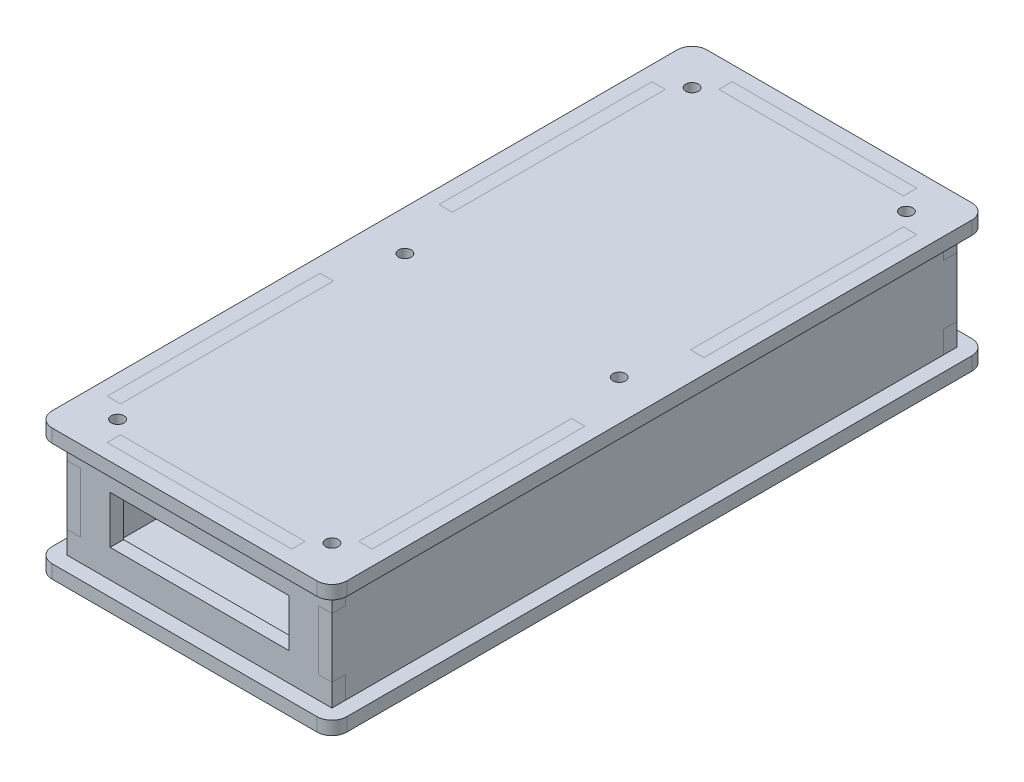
SolidWorks part; units mm, degrees
ref_plane "Front Plane" through (0, 0, 0) normal (0, 0, 1) x (1, 0, 0)
ref_plane "Top Plane" through (0, 0, 0) normal (0, 1, 0) x (1, 0, 0)
ref_plane "Right Plane" through (0, 0, 0) normal (1, 0, 0) x (0, 0, -1)
sketch "BasicDimensioning" plane through (0, 0, 0) normal (0, 1, 0) x (1, 0, 0)
  line L0 (-40, -986.8757) -> (-40, 49013.1243) construction
  line L1 (32, -54.5) -> (-32, -54.5) construction
  line L2 (32, -54.5) -> (32, 54.5) construction
  line L3 (32, 54.5) -> (-32, 54.5) construction
  line L4 (-32, -54.5) -> (-32, 54.5) construction
  line L5 (32, -54.5) -> (-32, 54.5) construction
  line L6 (32, 54.5) -> (-32, -54.5) construction
  line L7 (40, -980.6371) -> (40, 49019.3629) construction
  line L8 (44.5, -982.3385) -> (44.5, 49017.6615) construction
  line L9 (-44.5, -974.9657) -> (-44.5, 49025.0343) construction
  line L10 (-1005.6583, 67) -> (48994.3417, 67) construction
  line L11 (-1005.6583, 62.5) -> (48994.3417, 62.5) construction
  line L12 (-992.8068, -138.5) -> (49007.1932, -138.5) construction
  line L13 (-994.9176, -143) -> (49005.0824, -143) construction
  line L14 (-44.5, 67) -> (44.5, -143) construction
  line L16 (49.5, -148) -> (-49.5, -148) construction
  line L17 (49.5, -148) -> (49.5, 72) construction
  line L18 (49.5, 72) -> (-49.5, 72) construction
  line L19 (-49.5, -148) -> (-49.5, 72) construction
  line L20 (49.5, -148) -> (-49.5, 72) construction
  line L21 (49.5, 72) -> (-49.5, -148) construction
  line L22 (-36, 58.5) -> (36, 58.5) construction
  line L23 (-36, 58.5) -> (-36, -134.5) construction
  line L24 (-36, -134.5) -> (36, -134.5) construction
  line L25 (36, 58.5) -> (36, -134.5) construction
  circle A0 centre (-36, 58.5) radius 2.125 construction
  circle A1 centre (36, 58.5) radius 2.125 construction
  circle A2 centre (-36, -134.5) radius 2.125 construction
  circle A3 centre (36, -134.5) radius 2.125 construction
  circle A4 centre (-36, -38) radius 2.125 construction
  circle A5 centre (36, -38) radius 2.125 construction
  point P0 (0, 0)
  point P24 (35.1861, -38.4066)
  point P25 (0, -38)
  point P31 (35.9093, 58.0514)
  point P41 (-35.6819, -134.0892)
  point P44 (-35.6819, -38.4066)
  point P45 (-35.3893, -38)
sketch "Sketch2" plane through (0, 0, 0) normal (0, 1, 0) x (1, 0, 0)
  line L0 (-201005.6583, 67) -> (248994.3417, 67) construction
  line L1 (-44.5, 72) -> (44.5, 72)
  line L2 (-49.5, 67) -> (-49.5, -143)
  line L3 (-44.5, -148) -> (44.5, -148)
  line L4 (49.5, 67) -> (49.5, -143)
  line L5 (-31, 67) -> (31, 67)
  line L6 (-31, 67) -> (-31, 62.5)
  line L7 (-31, 62.5) -> (31, 62.5)
  line L8 (31, 67) -> (31, 62.5)
  line L9 (-201005.6583, 62.5) -> (248994.3417, 62.5) construction
  line L10 (-200992.8068, -138.5) -> (249007.1932, -138.5) construction
  line L11 (-31, -138.5) -> (31, -138.5)
  line L12 (-31, -138.5) -> (-31, -143)
  line L13 (-31, -143) -> (31, -143)
  line L14 (31, -138.5) -> (31, -143)
  line L15 (-200994.9176, -143) -> (249005.0824, -143) construction
  line L16 (-44.5, -200974.9657) -> (-44.5, 249025.0343) construction
  line L17 (-44.5, 53.5) -> (-40, 53.5)
  line L18 (-44.5, 53.5) -> (-44.5, -18)
  line L19 (-44.5, -18) -> (-40, -18)
  line L20 (-40, 53.5) -> (-40, -18)
  line L21 (-40, -200986.8757) -> (-40, 249013.1243) construction
  line L22 (40, -200980.6371) -> (40, 249019.3629) construction
  line L23 (-44.5, -58) -> (-40, -58)
  line L24 (-44.5, -58) -> (-44.5, -129.5)
  line L25 (-44.5, -129.5) -> (-40, -129.5)
  line L26 (-40, -58) -> (-40, -129.5)
  line L27 (40, 53.5) -> (44.5, 53.5)
  line L28 (40, 53.5) -> (40, -18)
  line L29 (40, -18) -> (44.5, -18)
  line L30 (44.5, 53.5) -> (44.5, -18)
  line L31 (44.5, -200982.3385) -> (44.5, 249017.6615) construction
  line L33 (40, -58) -> (44.5, -58)
  line L34 (40, -58) -> (40, -129.5)
  line L35 (40, -129.5) -> (44.5, -129.5)
  line L36 (44.5, -58) -> (44.5, -129.5)
  arc A0 (-49.5, -143) -> (-44.5, -148) centre (-44.5, -143) ccw
  arc A1 (44.5, -148) -> (49.5, -143) centre (44.5, -143) ccw
  arc A2 (44.5, 72) -> (49.5, 67) centre (44.5, 67) cw
  arc A3 (-44.5, 72) -> (-49.5, 67) centre (-44.5, 67) ccw
  circle A4 centre (-36, 58.5) radius 2.125
  circle A5 centre (36, 58.5) radius 2.125
  circle A6 centre (36, -38) radius 2.125
  circle A7 centre (36, -134.5) radius 2.125
  circle A8 centre (-36, -134.5) radius 2.125
  circle A9 centre (-36, -38) radius 2.125
  circle A10 centre (-36, 58.5) radius 2.125 construction
  point P10 (49.5, -148)
  point P15 (-49.5, 72)
  point P76 (31, 64.75)
extrude "Boss-Extrude1" add sketch "Sketch2" along normal blind 4.5
sketch "Sketch3" plane through (0, 0, -62.5) normal (0, 0, -1) x (-1, 0, 0)
  line L0 (-44.5, 4.5) -> (-31, 4.5)
  line L1 (-31, 4.5) -> (-31, 0)
  line L2 (-31, 0) -> (31, 0)
  line L3 (31, 0) -> (31, 4.5)
  line L4 (31, 4.5) -> (44.5, 4.5)
  line L5 (44.5, 4.5) -> (44.5, 12)
  line L6 (44.5, 12) -> (40, 12)
  line L7 (40, 32) -> (40, 12)
  line L8 (44.5, 32) -> (40, 32)
  line L9 (0, 0) -> (0, 44) construction
  line L10 (0, 22) -> (40, 22) construction
  line L11 (44.5, 39.5) -> (44.5, 32)
  line L12 (31, 39.5) -> (44.5, 39.5)
  line L13 (31, 44) -> (31, 39.5)
  line L14 (-31, 44) -> (31, 44)
  line L15 (-31, 39.5) -> (-31, 44)
  line L16 (-44.5, 39.5) -> (-31, 39.5)
  line L17 (-44.5, 4.5) -> (-44.5, 12)
  line L18 (-44.5, 12) -> (-40, 12)
  line L19 (-40, 32) -> (-40, 12)
  line L20 (-44.5, 32) -> (-40, 32)
  line L21 (-44.5, 39.5) -> (-44.5, 32)
extrude "Boss-Extrude2" add sketch "Sketch3" along normal blind 4.5 separate body
sketch "Sketch4" plane through (0, 0, 138.5) normal (0, 0, 1) x (1, 0, 0)
  line L0 (-40, 22) -> (40, 22) construction
  line L2 (30, 14) -> (-30, 14)
  line L3 (30, 14) -> (30, 30)
  line L4 (30, 30) -> (-30, 30)
  line L5 (-30, 14) -> (-30, 30)
  line L6 (30, 14) -> (-30, 30) construction
  line L7 (30, 30) -> (-30, 14) construction
  line L20 (44.5, 4.5) -> (44.5, 12)
  line L21 (31, 4.5) -> (44.5, 4.5)
  line L22 (31, 0) -> (31, 4.5)
  line L23 (-31, 0) -> (31, 0)
  line L24 (-31, 4.5) -> (-31, 0)
  line L25 (-44.5, 4.5) -> (-31, 4.5)
  line L26 (-44.5, 12) -> (-44.5, 4.5)
  line L27 (-40, 12) -> (-44.5, 12)
  line L28 (-40, 32) -> (-40, 12)
  line L29 (-44.5, 32) -> (-40, 32)
  line L30 (-44.5, 39.5) -> (-44.5, 32)
  line L31 (-31, 39.5) -> (-44.5, 39.5)
  line L32 (-31, 44) -> (-31, 39.5)
  line L33 (31, 44) -> (-31, 44)
  line L34 (31, 39.5) -> (31, 44)
  line L35 (44.5, 39.5) -> (31, 39.5)
  line L36 (44.5, 32) -> (44.5, 39.5)
  line L37 (40, 32) -> (44.5, 32)
  line L38 (40, 12) -> (40, 32)
  line L39 (44.5, 12) -> (40, 12)
  line L40 (44.5, 4.5) -> (44.5, 12)
  line L41 (31, 4.5) -> (44.5, 4.5)
  line L42 (31, 0) -> (31, 4.5)
  line L43 (-31, 0) -> (31, 0)
  line L44 (-31, 4.5) -> (-31, 0)
  line L45 (-44.5, 4.5) -> (-31, 4.5)
  line L46 (-44.5, 12) -> (-44.5, 4.5)
  line L47 (-40, 12) -> (-44.5, 12)
  line L48 (-40, 32) -> (-40, 12)
  line L49 (-44.5, 32) -> (-40, 32)
  line L50 (-44.5, 39.5) -> (-44.5, 32)
  line L51 (-31, 39.5) -> (-44.5, 39.5)
  line L52 (-31, 44) -> (-31, 39.5)
  line L53 (31, 44) -> (-31, 44)
  line L54 (31, 39.5) -> (31, 44)
  line L55 (44.5, 39.5) -> (31, 39.5)
  line L56 (44.5, 32) -> (44.5, 39.5)
  line L57 (40, 32) -> (44.5, 32)
  line L58 (40, 12) -> (40, 32)
  line L59 (44.5, 12) -> (40, 12)
  point P22 (0, 22)
  dimension "D2" = 60
  dimension "D3" = 16
  dimension "D1" = 0
extrude "Boss-Extrude3" add sketch "Sketch4" along normal blind 4.5 separate body
sketch "Sketch5" plane through (-40, 0, 0) normal (-1, 0, 0) x (0, 0, 1)
  line L0 (-67, 22) -> (143, 22) construction
  line L1 (-67, 12) -> (-67, 32) construction
  line L2 (143, 32) -> (143, 12) construction
  line L3 (-67, 32) -> (-67, 12)
  line L4 (-67, 12) -> (-62.5, 12)
  line L5 (-62.5, 12) -> (-62.5, 4.5)
  line L6 (-62.5, 4.5) -> (-53.5, 4.5)
  line L7 (-53.5, 4.5) -> (-53.5, 0)
  line L8 (-53.5, 0) -> (18, 0)
  line L9 (18, 0) -> (18, 4.5)
  line L10 (18, 4.5) -> (58, 4.5)
  line L11 (58, 4.5) -> (58, 0)
  line L12 (58, 0) -> (129.5, 0)
  line L13 (129.5, 0) -> (129.5, 4.5)
  line L14 (129.5, 4.5) -> (138.5, 4.5)
  line L15 (138.5, 4.5) -> (138.5, 12)
  line L16 (138.5, 12) -> (143, 12)
  line L17 (143, 12) -> (143, 32)
  line L18 (-67, 32) -> (-62.5, 32)
  line L19 (-62.5, 32) -> (-62.5, 39.5)
  line L20 (-62.5, 39.5) -> (-53.5, 39.5)
  line L21 (-53.5, 39.5) -> (-53.5, 44)
  line L22 (-53.5, 44) -> (18, 44)
  line L23 (18, 44) -> (18, 39.5)
  line L24 (18, 39.5) -> (58, 39.5)
  line L25 (58, 39.5) -> (58, 44)
  line L26 (58, 44) -> (129.5, 44)
  line L27 (129.5, 44) -> (129.5, 39.5)
  line L28 (129.5, 39.5) -> (138.5, 39.5)
  line L29 (138.5, 39.5) -> (138.5, 32)
  line L30 (138.5, 32) -> (143, 32)
extrude "Boss-Extrude4" add sketch "Sketch5" along normal blind 4.5 separate body
mirror "Mirror1" about plane through (0, 0, 0) normal (1, 0, 0)
sketch "Sketch6" plane through (0, 39.5, 0) normal (0, 1, 0) x (1, 0, 0)
  line L1 (-40, -18) -> (-44.5, -18) construction
  line L2 (-44.5, -18) -> (-44.5, 53.5) construction
  line L3 (-44.5, 53.5) -> (-40, 53.5) construction
  line L4 (-40, -58) -> (-40, -18)
  line L5 (-40, -18) -> (-44.5, -18)
  line L6 (-44.5, -18) -> (-44.5, -58)
  line L7 (-44.5, -58) -> (-40, -58)
  line L11 (-44.5, -58) -> (-40, -58)
  line L12 (-49.5, 67) -> (-49.5, -143)
  line L13 (44.5, 72) -> (-44.5, 72)
  line L14 (49.5, -143) -> (49.5, 67)
  line L15 (-44.5, -148) -> (44.5, -148)
  line L16 (-49.5, 67) -> (-49.5, -143)
  line L17 (44.5, 72) -> (-44.5, 72)
  line L18 (49.5, -143) -> (49.5, 67)
  line L19 (-44.5, -148) -> (44.5, -148)
  line L20 (31, 62.5) -> (-31, 62.5) construction
  line L21 (-31, 62.5) -> (-31, 67) construction
  line L22 (-31, 67) -> (31, 67) construction
  line L23 (31, 67) -> (31, 62.5) construction
  line L24 (40, -18) -> (40, 53.5) construction
  line L25 (40, 53.5) -> (44.5, 53.5) construction
  line L26 (44.5, 53.5) -> (44.5, -18) construction
  line L27 (44.5, -18) -> (40, -18) construction
  line L28 (40, -129.5) -> (40, -58) construction
  line L29 (40, -58) -> (44.5, -58) construction
  line L30 (44.5, -58) -> (44.5, -129.5) construction
  line L31 (44.5, -129.5) -> (40, -129.5) construction
  line L32 (-31, -138.5) -> (31, -138.5) construction
  line L33 (31, -138.5) -> (31, -143) construction
  line L34 (31, -143) -> (-31, -143) construction
  line L35 (-31, -143) -> (-31, -138.5) construction
  line L36 (-40, -58) -> (-40, -129.5) construction
  line L37 (-40, -129.5) -> (-44.5, -129.5) construction
  line L38 (-44.5, -129.5) -> (-44.5, -58) construction
  line L39 (-44.5, -58) -> (-40, -58) construction
  line L41 (-40, -18) -> (-44.5, -18)
  line L42 (-44.5, -18) -> (-44.5, 53.5)
  line L43 (-44.5, 53.5) -> (-40, 53.5)
  line L44 (31, 62.5) -> (-31, 62.5)
  line L45 (-31, 62.5) -> (-31, 67)
  line L46 (-31, 67) -> (31, 67)
  line L47 (31, 67) -> (31, 62.5)
  line L48 (40, -18) -> (40, 53.5)
  line L49 (40, 53.5) -> (44.5, 53.5)
  line L50 (44.5, 53.5) -> (44.5, -18)
  line L51 (44.5, -18) -> (40, -18)
  line L52 (40, -129.5) -> (40, -58)
  line L53 (40, -58) -> (44.5, -58)
  line L54 (44.5, -58) -> (44.5, -129.5)
  line L55 (44.5, -129.5) -> (40, -129.5)
  line L56 (-31, -138.5) -> (31, -138.5)
  line L57 (31, -138.5) -> (31, -143)
  line L58 (31, -143) -> (-31, -143)
  line L59 (-31, -143) -> (-31, -138.5)
  line L60 (-40, -58) -> (-40, -129.5)
  line L61 (-40, -129.5) -> (-44.5, -129.5)
  line L62 (-44.5, -129.5) -> (-44.5, -58)
  line L63 (-44.5, -58) -> (-40, -58)
  line L64 (-40, 53.5) -> (-40, -18)
  circle A0 centre (36, -134.5) radius 2.125 construction
  circle A1 centre (-36, -38) radius 2.125 construction
  circle A2 centre (36, -38) radius 2.125 construction
  circle A3 centre (36, 58.5) radius 2.125 construction
  arc A4 (-49.5, -143) -> (-44.5, -148) centre (-44.5, -143) ccw
  arc A5 (-44.5, 72) -> (-49.5, 67) centre (-44.5, 67) ccw
  arc A6 (49.5, 67) -> (44.5, 72) centre (44.5, 67) ccw
  arc A7 (44.5, -148) -> (49.5, -143) centre (44.5, -143) ccw
  arc A8 (-49.5, -143) -> (-44.5, -148) centre (-44.5, -143) ccw
  arc A9 (-44.5, 72) -> (-49.5, 67) centre (-44.5, 67) ccw
  arc A10 (49.5, 67) -> (44.5, 72) centre (44.5, 67) ccw
  arc A11 (44.5, -148) -> (49.5, -143) centre (44.5, -143) ccw
  circle A12 centre (-36, 58.5) radius 2.125 construction
  circle A13 centre (-36, -134.5) radius 2.125 construction
  circle A14 centre (36, -134.5) radius 2.125
  circle A15 centre (-36, -38) radius 2.125
  circle A16 centre (36, -38) radius 2.125
  circle A17 centre (36, 58.5) radius 2.125
  circle A18 centre (-36, 58.5) radius 2.125
  circle A19 centre (-36, -134.5) radius 2.125
  dimension "D1" = 0
  dimension "D2" = 0
extrude "Boss-Extrude5" add sketch "Sketch6" along normal blind 4.5 separate body
equation "\"ThIck\"= 4.5"
equation "\"D3@BasicDimensioning\" = \"ThIck\""
equation "\"D4@BasicDimensioning\" = \"ThIck\""
equation "\"D5@BasicDimensioning\" = \"ThIck\""
equation "\"D6@BasicDimensioning\" = \"ThIck\""
equation "\"D4@Sketch2\"=\"D2@Sketch2\""
equation "\"D5@Sketch2\"=\"D4@Sketch2\""
equation "\"D3@Sketch2\"=\"D2@Sketch2\""
equation "\"D7@Sketch2\"=\"D6@Sketch2\""
equation "\"D8@Sketch2\"=\"D7@Sketch2\""
equation "\"D9@Sketch2\"=\"D6@Sketch2\""
equation "\"D10@Sketch2\"=\"D5@Sketch2\""
equation "\"D11@Sketch2\"=\"D5@Sketch2\""
equation "\"D12@Sketch2\"=\"D10@Sketch2\""
equation "\"D13@Sketch2\"=\"D11@Sketch2\""
equation "\"D1@Boss-Extrude1\"=\"ThIck\""
equation "\"D2@Sketch3\"=\"ThIck\""
equation "\"D1@Boss-Extrude2\"=\"ThIck\""
equation "\"D1@Boss-Extrude3\"=\"ThIck\""
equation "\"D1@Boss-Extrude4\"=\"ThIck\""
equation "\"D1@Boss-Extrude5\"=\"ThIck\""
